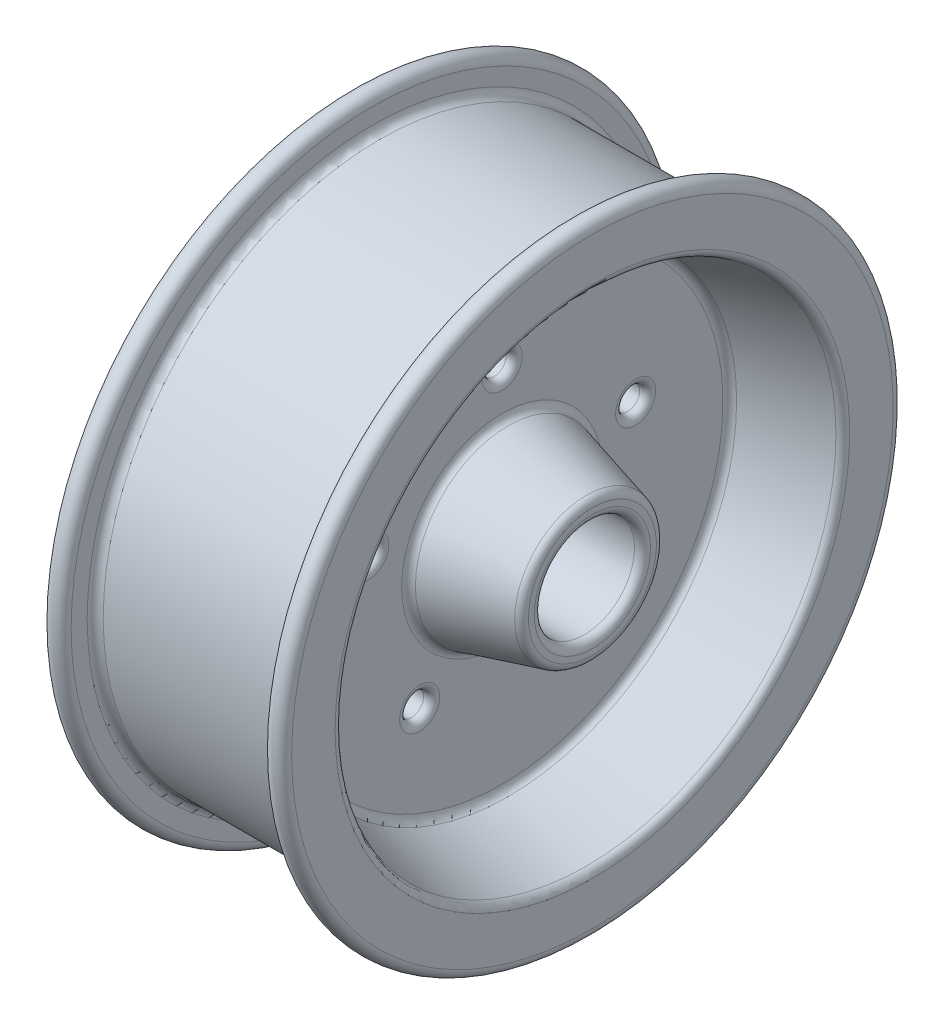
SolidWorks part; units mm, degrees
ref_plane "Front Plane" through (0, 0, 0) normal (0, 0, 1) x (1, 0, 0)
ref_plane "Top Plane" through (0, 0, 0) normal (0, 1, 0) x (1, 0, 0)
ref_plane "Right Plane" through (0, 0, 0) normal (1, 0, 0) x (0, 0, -1)
sketch "Sketch1" plane through (0, 0, 0) normal (0, 0, 1) x (1, 0, 0)
  line L0 (0, 0) -> (50.6631, 0) construction
  line L1 (0, 0) -> (0, 87.63) construction
  line L2 (-38.1, 15.875) -> (38.1, 15.875)
  line L3 (38.1, 15.875) -> (38.1, 22.225)
  line L4 (-38.1, 15.875) -> (-38.1, 22.225)
  line L5 (38.1, 22.225) -> (9.525, 29.8816)
  line L6 (-38.1, 22.225) -> (-9.525, 29.8816)
  line L7 (9.525, 29.8816) -> (9.525, 71.8708)
  line L8 (-9.525, 29.8816) -> (-9.525, 71.8708)
  line L9 (9.525, 71.8708) -> (38.1, 79.5274)
  line L10 (-9.525, 71.8708) -> (-38.1, 79.5274)
  line L11 (38.1, 79.5274) -> (38.1, 95.25)
  line L12 (-38.1, 79.5274) -> (-38.1, 95.25)
  line L13 (31.75, 95.25) -> (31.75, 87.63)
  line L14 (-31.75, 95.25) -> (-31.75, 87.63)
  line L15 (31.75, 87.63) -> (-31.75, 87.63)
  arc A0 (31.75, 95.25) -> (38.1, 95.25) centre (34.925, 95.25) cw
  arc A1 (-31.75, 95.25) -> (-38.1, 95.25) centre (-34.925, 95.25) ccw
  point P7 (0, 15.875)
  point P21 (0, 87.63)
  dimension "D6" = 10.795
  dimension "D9" = 76.2
  dimension "D1" = 31.75
  dimension "D2" = 6.35
  dimension "D3" = 57.3024
  dimension "D4" = 19.05
  dimension "D5" = 6.35
  dimension "D7" = 15
  dimension "D8" = 175.26
revolve "Revolve1" add sketch "Sketch1" angle 360 about L0
sketch "Sketch2" plane through (9.525, 0, 0) normal (1, 0, 0) x (0, 0, -1)
  circle A0 centre (0, 0) radius 44.45 construction
  circle A1 centre (0, 44.45) radius 3.81
  circle A2 centre (42.2745, 13.7358) radius 3.81
  circle A3 centre (26.1271, -35.9608) radius 3.81
  circle A4 centre (-26.1271, -35.9608) radius 3.81
  circle A5 centre (-42.2745, 13.7358) radius 3.81
  dimension "D1" = 88.9
  dimension "D2" = 7.62
  dimension "D4" = 72
  dimension "D3" = 5
extrude "Cut-Extrude1" cut sketch "Sketch2" against normal through all
fillet "Fillet1" radius 2.54 22 edges at (9.525, 13.7358, 38.4645) (-9.525, 13.7358, 38.4645) (9.525, -35.9608, 22.3171) (-9.525, -35.9608, 22.3171) (9.525, -35.9608, -29.9371) (-9.525, -35.9608, -29.9371) (9.525, 13.7358, -46.0845) (-9.525, 13.7358, -46.0845) (9.525, 44.45, -3.81) (-9.525, 44.45, -3.81) (-9.525, 0, 29.8816) (-9.525, 0, 71.8708) (-38.1, 0, 79.5274) (-31.75, 0, 87.63) (31.75, 0, 87.63) (38.1, 0, 79.5274) (9.525, 0, 71.8708) (9.525, 0, 29.8816) (38.1, 0, 22.225) (38.1, 0, 15.875) (-38.1, 0, 15.875) (-38.1, 0, 22.225)
